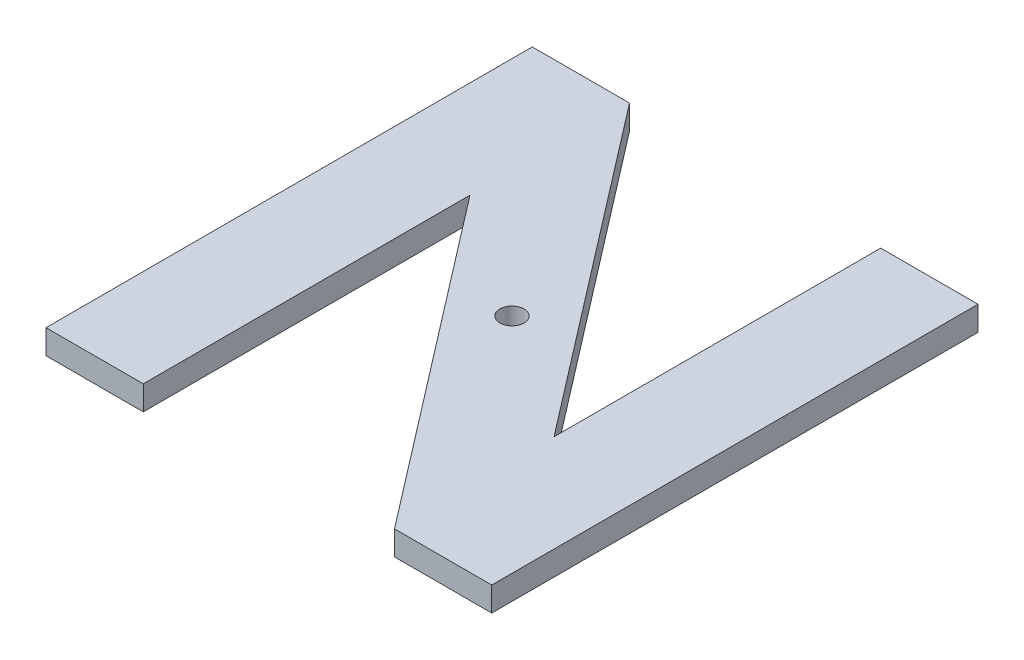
SolidWorks part; units mm, degrees
ref_plane "Front" through (0, 0, 0) normal (0, 0, 1) x (1, 0, 0)
ref_plane "Top" through (0, 0, 0) normal (0, 1, 0) x (1, 0, 0)
ref_plane "Right" through (0, 0, 0) normal (1, 0, 0) x (0, 0, -1)
sketch "Sketch1" plane through (0, 0, 0) normal (0, 1, 0) x (1, 0, 0)
  line L0 (43, 19.6859) -> (43, 60)
  line L1 (0, 0) -> (12, 0)
  line L2 (0, 0) -> (0, 60)
  line L3 (0, 60) -> (12, 60)
  line L4 (55, 0) -> (55, 60)
  line L5 (12, 0) -> (12, 40.3141)
  line L6 (43, 0) -> (55, 0)
  line L8 (12, 60) -> (43, 19.6859)
  line L9 (43, 0) -> (12, 40.3141)
  line L10 (43, 60) -> (55, 60)
  line L15 (43, 0) -> (43, 60) construction
  line L16 (12, 0) -> (12, 60) construction
  circle A0 centre (27.5, 30) radius 1.5
extrude "Extrude1" add sketch "Sketch1" along normal blind 3
